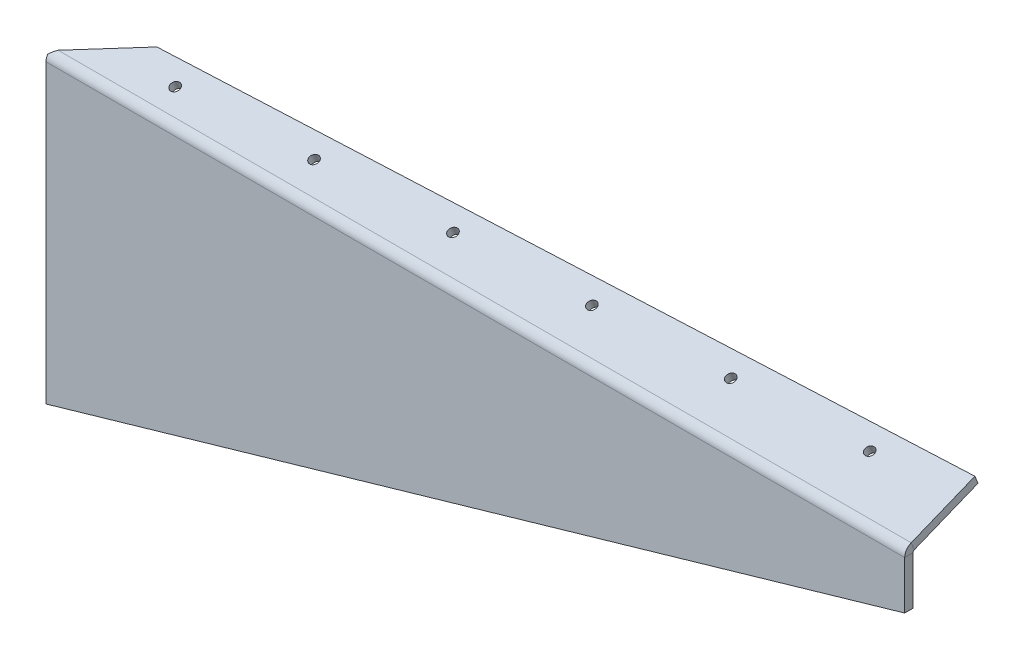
SolidWorks part; units mm, degrees
ref_plane "前视基准面" through (0, 0, 0) normal (0, 0, 1) x (1, 0, 0)
ref_plane "上视基准面" through (0, 0, 0) normal (0, 1, 0) x (1, 0, 0)
ref_plane "右视基准面" through (0, 0, 0) normal (1, 0, 0) x (0, 0, -1)
sketch "草图1" plane through (0, 0, 0) normal (0, 0, 1) x (1, 0, 0)
  line L0 (0, 0) -> (0, -290)
  line L1 (0, 0) -> (830, 0) construction
  line L2 (830, 70) -> (830, -50)
  line L3 (0, -290) -> (830, -50)
  line L4 (830, 70) -> (64.9576, 42.3479)
  line L5 (64.9576, 42.3479) -> (0, 0)
  point P0 (0, 40)
  dimension "D1" = 330
  dimension "D2" = 40
  dimension "D3" = 830
  dimension "D4" = 70
  dimension "D5" = 120
  dimension "D6" = 40
  dimension "D7" = 65
sheet metal parameters "钣金1" thickness 8 parameters "D1"=2
base flange "基体-法兰1" sketch "草图1" thickness 8 reverse thickness direction yes parameters "D1"=2
sketch "草图3" plane through (0, 0, 0) normal (0, 0, -1) x (-1, 0, 0)
  line L0 (0, 0) -> (-913.9229, 0)
sketched bend "绘制的折弯1" parameters "D1"=2
bend "草图折弯1" bend radius 2 bend angle 68 parameters "D5"=1
sketch "草图4" plane through (0, 5.5163, 2.2288) normal (0, 0.9272, 0.3746) x (1, 0, 0)
  line L0 (0, -0.5978) -> (0, -5.0713) construction
  line L1 (830, 66.9601) -> (64.9576, 39.308) construction
  circle A0 centre (100, 20.5615) radius 4.5
  point P2 (0, -2.8346)
  dimension "D1" = 9
  dimension "D2" = 100
  dimension "D3" = 20
extrude "拉伸1" cut sketch "草图4" against normal blind 10
pattern_linear "阵列(线性)1" count 6 spacing 130 along (0.9993, 0.0135, -0.0335) of "拉伸1"
flat pattern "平板型式1"
sketch "折弯-线1" plane through (0, 0, 0) normal (0, 1, 0) x (-1, 0, 0)
bend of the flat pattern "展开-<草图折弯1>1"
